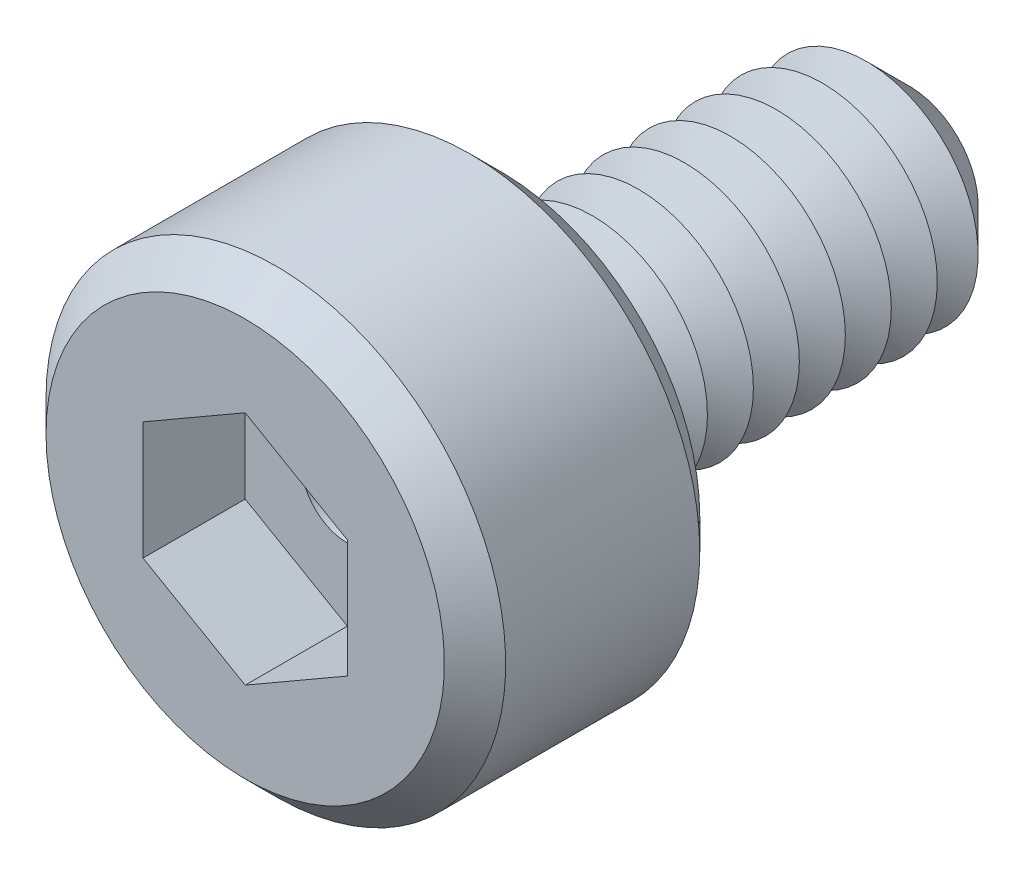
SolidWorks part; units mm, degrees
ref_plane "Front Plane" through (0, 0, 0) normal (0, 0, 1) x (1, 0, 0)
ref_plane "Top Plane" through (0, 0, 0) normal (0, 1, 0) x (1, 0, 0)
ref_plane "Right Plane" through (0, 0, 0) normal (1, 0, 0) x (0, 0, -1)
sketch "Sketch1" plane through (0, 0, 0) normal (0, 0, 1) x (1, 0, 0)
  circle A0 centre (0, 0) radius 2.25
  dimension "D1" = 4.5
extrude "Boss-Extrude1" add sketch "Sketch1" along normal blind 2.5
sketch "Sketch2" plane through (0, 0, 0) normal (0, 0, -1) x (-1, 0, 0)
  circle A0 centre (0, 0) radius 1.125
  dimension "D1" = 2.25
extrude "Boss-Extrude2" add sketch "Sketch2" along normal blind 4
chamfer "Chamfer1" distance 0.45 angle 45 1 edges at (-1.125, 0, -4)
sketch "Sketch3" plane through (0, 0, 0) normal (1, 0, 0) x (0, 0, -1)
  line L0 (-2.5121, 0) -> (4.5776, 0) construction
sketch "Sketch4" plane through (0, 0, 0) normal (1, 0, 0) x (0, 0, -1)
  line L0 (0, 1.125) -> (0.225, 0.7353)
  line L1 (0.225, 0.7353) -> (0.45, 1.125)
  line L2 (3.55, 1.125) -> (0, 1.125) construction
  line L3 (0.45, 1.125) -> (0, 1.125)
  dimension "D1" = 0.45
revolve "Cut-Revolve1" cut sketch "Sketch4" angle 360 about L0
pattern_linear "LPattern1" count 8 spacing 0.45 along (0, 0, -1) of "Cut-Revolve1"
sketch "Sketch5" plane through (0, 0, 2.5) normal (0, 0, 1) x (1, 0, 0)
  line L1 (0, 1.1547) -> (-1, 0.5774)
  line L2 (-1, 0.5774) -> (-1, -0.5774)
  line L3 (-1, -0.5774) -> (0, -1.1547)
  line L4 (0, -1.1547) -> (1, -0.5774)
  line L5 (1, -0.5774) -> (1, 0.5774)
  line L6 (1, 0.5774) -> (0, 1.1547)
  circle A0 centre (0, 0) radius 1 construction
  dimension "D1" = 2
extrude "Cut-Extrude1" cut sketch "Sketch5" against normal blind 1
sketch "Sketch6" plane through (0, 0, 1.5) normal (0, 0, 1) x (1, 0, 0)
  circle A0 centre (0, 0) radius 0.45
  dimension "D1" = 0.9
extrude "Cut-Extrude2" cut sketch "Sketch6" against normal up to surface (5.5 mm away)
chamfer "Chamfer2" distance 0.3 angle 45 2 edges at (2.25, 0, 0) (2.25, 0, 2.5)
